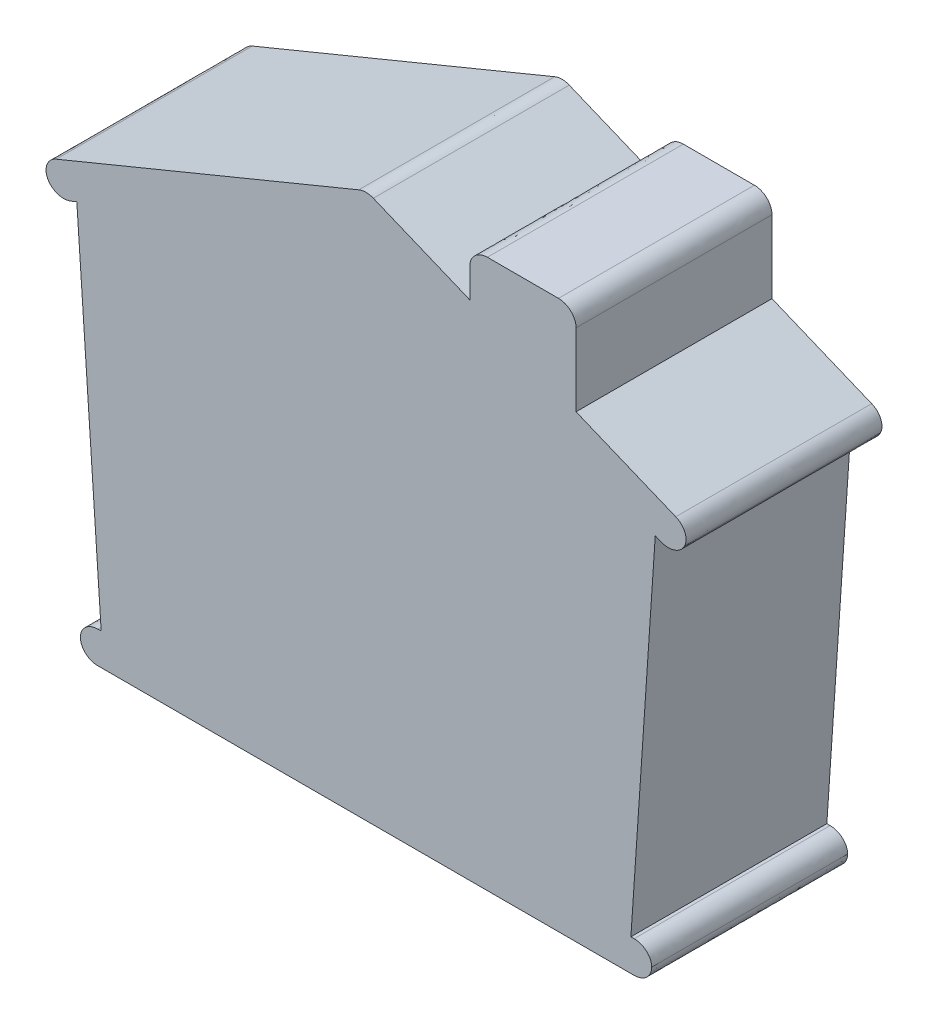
SolidWorks part; units mm, degrees
ref_plane "Front Plane" through (0, 0, 0) normal (0, 0, 1) x (1, 0, 0)
ref_plane "Top Plane" through (0, 0, 0) normal (0, 1, 0) x (1, 0, 0)
ref_plane "Right Plane" through (0, 0, 0) normal (1, 0, 0) x (0, 0, -1)
sketch "Sketch1" plane through (0, 0, 0) normal (0, 0, 1) x (1, 0, 0)
  line L0 (50.9816, -117.1123) -> (50.975, -117.099)
  line L1 (132.2426, -117.0989) -> (132.2359, -117.1123)
  line L2 (125.8147, -163.7022) -> (125.4023, -163.7022)
  line L3 (57.403, -163.7022) -> (57.8154, -163.7022)
  spline S0 degree 3 poles (57.8154, -163.7022) (56.7793, -148.4156) (55.7429, -133.106) (54.7064, -117.828) knots 0 0 0 0 0.034483 0.034483 0.034483 0.034483
  spline S1 degree 2 poles (54.7064, -117.828) (54.7064, -117.828) (53.9448, -118.1359) knots 0.034483 0.034483 0.034483 0.068966 0.068966 0.068966
  spline S2 degree 3 poles (53.9448, -118.1359) (52.8171, -118.5916) (51.4889, -118.1306) (50.9816, -117.1123) knots 0.068966 0.068966 0.068966 0.068966 0.103448 0.103448 0.103448 0.103448
  spline S3 degree 3 poles (50.975, -117.099) (50.4701, -116.0854) (50.9736, -114.8874) (52.0925, -114.4262) knots 0.137931 0.137931 0.137931 0.137931 0.172414 0.172414 0.172414 0.172414
  spline S4 degree 2 poles (52.0925, -114.4262) (52.0925, -114.4262) (90.6783, -98.5226) knots 0.172414 0.172414 0.172414 0.206897 0.206897 0.206897
  spline S5 degree 3 poles (90.6783, -98.5226) (91.2906, -98.2702) (91.9271, -98.2703) (92.5394, -98.5226) knots 0.206897 0.206897 0.206897 0.206897 0.241379 0.241379 0.241379 0.241379
  spline S6 degree 2 poles (92.5394, -98.5226) (92.5394, -98.5226) (104.8464, -103.5952) knots 0.241379 0.241379 0.241379 0.275862 0.275862 0.275862
  spline S7 degree 2 poles (104.8464, -103.5952) (104.8464, -103.5952) (104.8464, -99.9015) knots 0.275862 0.275862 0.275862 0.310345 0.310345 0.310345
  spline S8 degree 3 poles (104.8464, -99.9015) (104.8464, -98.7249) (105.8539, -97.7648) (107.0894, -97.7653) knots 0.310345 0.310345 0.310345 0.310345 0.344828 0.344828 0.344828 0.344828
  spline S9 degree 2 poles (107.0894, -97.7653) (107.0894, -97.7653) (116.1627, -97.7704) knots 0.344828 0.344828 0.344828 0.37931 0.37931 0.37931
  spline S10 degree 3 poles (116.1627, -97.7704) (117.3981, -97.7709) (118.4057, -98.7303) (118.4057, -99.9065) knots 0.37931 0.37931 0.37931 0.37931 0.413793 0.413793 0.413793 0.413793
  spline S11 degree 2 poles (118.4057, -99.9065) (118.4057, -99.9065) (118.4057, -109.1839) knots 0.413793 0.413793 0.413793 0.448276 0.448276 0.448276
  spline S12 degree 2 poles (118.4057, -109.1839) (118.4057, -109.1839) (131.1251, -114.4261) knots 0.448276 0.448276 0.448276 0.482759 0.482759 0.482759
  spline S13 degree 3 poles (131.1251, -114.4261) (132.244, -114.8872) (132.7419, -116.0834) (132.2426, -117.0989) knots 0.482759 0.482759 0.482759 0.482759 0.517241 0.517241 0.517241 0.517241
  spline S14 degree 3 poles (132.2359, -117.1123) (131.7319, -118.1317) (130.4006, -118.5917) (129.2729, -118.1359) knots 0.551724 0.551724 0.551724 0.551724 0.586207 0.586207 0.586207 0.586207
  spline S15 degree 2 poles (129.2729, -118.1359) (129.2729, -118.1359) (128.5113, -117.828) knots 0.586207 0.586207 0.586207 0.62069 0.62069 0.62069
  spline S16 degree 3 poles (128.5113, -117.828) (127.4748, -133.106) (126.4383, -148.4156) (125.4023, -163.7022) knots 0.62069 0.62069 0.62069 0.62069 0.655172 0.655172 0.655172 0.655172
  spline S17 degree 3 poles (125.8147, -163.7022) (127.0501, -163.7022) (128.0577, -164.6131) (128.0577, -165.7299) knots 0.689655 0.689655 0.689655 0.689655 0.724138 0.724138 0.724138 0.724138
  spline S18 degree 3 poles (128.0577, -165.7299) (128.0577, -166.8468) (127.0501, -167.7577) (125.8147, -167.7577) knots 0.758621 0.758621 0.758621 0.758621 0.793103 0.793103 0.793103 0.793103
  spline S19 degree 2 poles (125.8147, -167.7577) (125.8147, -167.7577) (57.403, -167.7577) knots 0.793103 0.793103 0.793103 0.827586 0.827586 0.827586
  spline S20 degree 3 poles (57.403, -167.7577) (56.1676, -167.7577) (55.16, -166.8468) (55.16, -165.7299) knots 0.827586 0.827586 0.827586 0.827586 0.862069 0.862069 0.862069 0.862069
  spline S21 degree 3 poles (55.16, -165.7299) (55.16, -164.6131) (56.1676, -163.7022) (57.403, -163.7022) knots 0.896552 0.896552 0.896552 0.896552 0.931034 0.931034 0.931034 0.931034
extrude "Boss-Extrude1" add sketch "Sketch1" along normal blind 25
